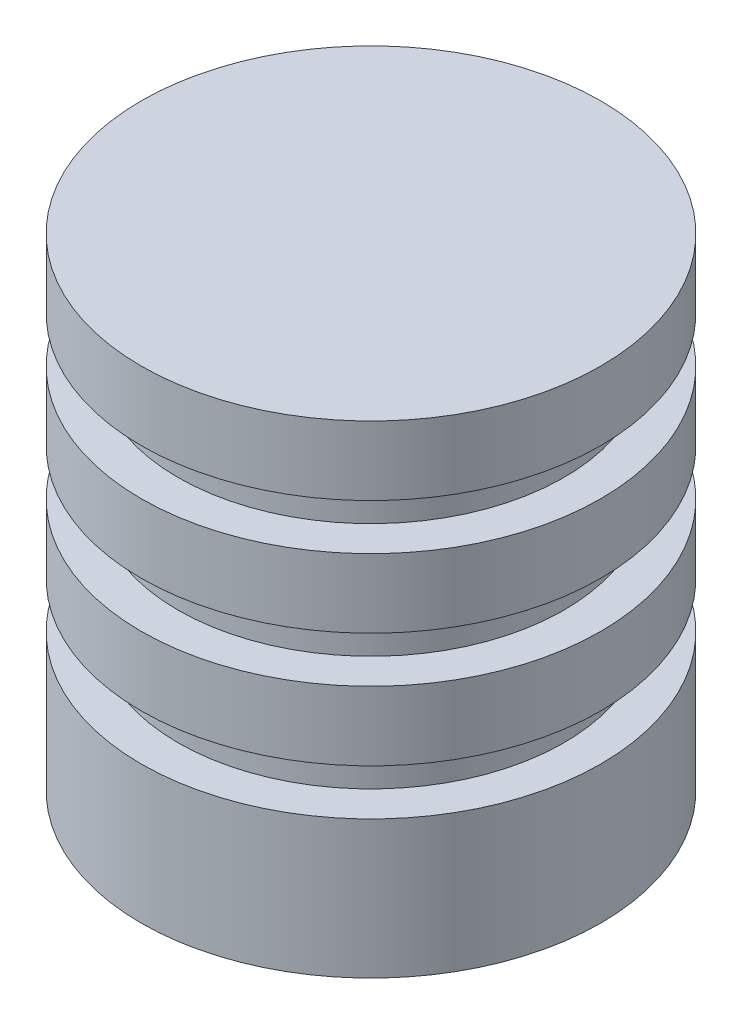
SolidWorks part; units mm, degrees
ref_plane "Płaszczyzna przednia" through (0, 0, 0) normal (0, 0, 1) x (1, 0, 0)
ref_plane "Płaszczyzna górna" through (0, 0, 0) normal (0, 1, 0) x (1, 0, 0)
ref_plane "Płaszczyzna prawa" through (0, 0, 0) normal (1, 0, 0) x (0, 0, -1)
sketch "Szkic1" plane through (0, 0, 0) normal (0, 0, 1) x (1, 0, 0)
  line L0 (0, 95) -> (0, 105)
  line L1 (0, 105) -> (50, 105)
  line L2 (50, 105) -> (50, 0)
  line L3 (50, 0) -> (35, 0)
  line L4 (35, 0) -> (35, 60)
  line L5 (35, 60) -> (14.7927, 95)
  line L6 (14.7927, 95) -> (0, 95)
  line L7 (0, 0) -> (0, 95) construction
  dimension "D1" = 105
  dimension "D2" = 100
  dimension "D3" = 70
  dimension "D4" = 10
  dimension "D5" = 60
  dimension "D6" = 120
revolve "Obrót1" add sketch "Szkic1" angle 360 about L7
sketch "Szkic2" plane through (0, 105, 0) normal (0, 1, 0) x (1, 0, 0)
  circle A2 centre (0, 0) radius 42
  circle A3 centre (0, 0) radius 42
  dimension "D1" = 8
extrude "Wytnij-wyciągnięcie1" cut sketch "Szkic2" against normal blind 10 from offset 15 flip side to cut
pattern_linear "Szyk liniowy1" count 3 spacing 25 along (0, -1, 0) of "Wytnij-wyciągnięcie1"
